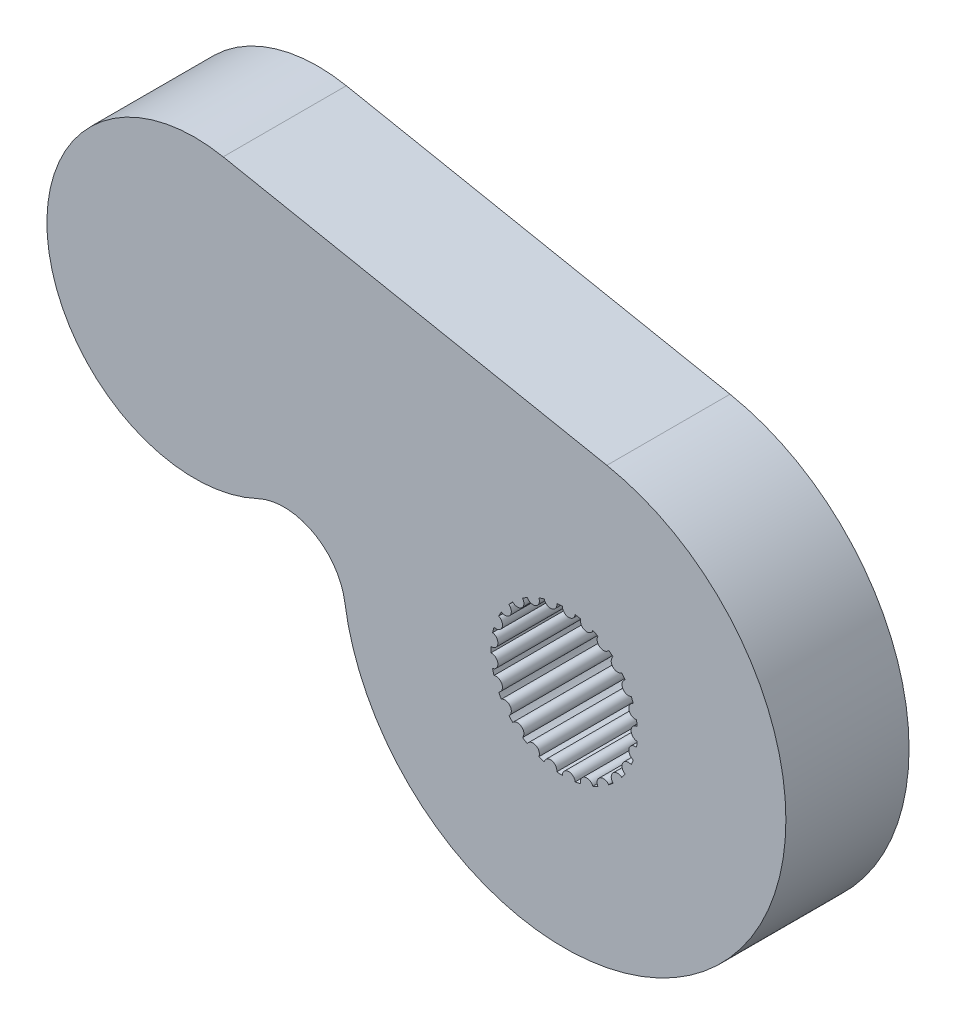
SolidWorks part; units mm, degrees
ref_plane "Plan de face" through (0, 0, 0) normal (0, 0, 1) x (1, 0, 0)
ref_plane "Plan de dessus" through (0, 0, 0) normal (0, 1, 0) x (1, 0, 0)
ref_plane "Plan de droite" through (0, 0, 0) normal (1, 0, 0) x (0, 0, -1)
sketch "Esquisse1" plane through (0, 0, 0) normal (0, 0, 1) x (1, 0, 0)
  line L0 (0, 0) -> (-29.8495, 0) construction
  line L1 (-15, 14.3723) -> (-15, -5.8431) construction
  line L2 (-13.8449, 11.8878) -> (1.7327, 8.8316)
  circle A0 centre (0, 0) radius 2.975
  arc A1 (-8.9025, -1.3214) -> (1.7327, 8.8316) centre (0, 0) ccw
  arc A2 (-13.8449, 11.8878) -> (-12.4414, 0.5729) centre (-15, 6) ccw
  arc A3 (-8.9025, -1.3214) -> (-12.4414, 0.5729) centre (-11.3754, -1.6884) ccw
  dimension "D1" = 5.95
  dimension "D2" = 18
  dimension "D3" = 15
  dimension "D4" = 12
  dimension "D5" = 5
extrude "Boss.-Extru.1" add sketch "Esquisse1" along normal blind 5
sketch "Esquisse4" plane through (0, 0, 5) normal (0, 0, 1) x (1, 0, 0)
  circle A0 centre (2.975, 0) radius 0.26
  circle A1 centre (0, 0) radius 2.975 construction
  circle A2 centre (2.8815, -0.7399) radius 0.26
  circle A3 centre (2.607, -1.4332) radius 0.26
  circle A4 centre (2.1687, -2.0365) radius 0.26
  circle A5 centre (1.5941, -2.5119) radius 0.26
  circle A6 centre (0.9193, -2.8294) radius 0.26
  circle A7 centre (0.1868, -2.9691) radius 0.26
  circle A8 centre (-0.5575, -2.9223) radius 0.26
  circle A9 centre (-1.2667, -2.6919) radius 0.26
  circle A10 centre (-1.8963, -2.2923) radius 0.26
  circle A11 centre (-2.4068, -1.7487) radius 0.26
  circle A12 centre (-2.7661, -1.0952) radius 0.26
  circle A13 centre (-2.9515, -0.3729) radius 0.26
  circle A14 centre (-2.9515, 0.3729) radius 0.26
  circle A15 centre (-2.7661, 1.0952) radius 0.26
  circle A16 centre (-2.4068, 1.7487) radius 0.26
  circle A17 centre (-1.8963, 2.2923) radius 0.26
  circle A18 centre (-1.2667, 2.6919) radius 0.26
  circle A19 centre (-0.5575, 2.9223) radius 0.26
  circle A20 centre (0.1868, 2.9691) radius 0.26
  circle A21 centre (0.9193, 2.8294) radius 0.26
  circle A22 centre (1.5941, 2.5119) radius 0.26
  circle A23 centre (2.1687, 2.0365) radius 0.26
  circle A24 centre (2.607, 1.4332) radius 0.26
  circle A25 centre (2.8815, 0.7399) radius 0.26
  point P55 (0, 0)
  dimension "D1" = 0.52
  dimension "D2" = 25
extrude "Boss.-Extru.3" add sketch "Esquisse4" against normal blind 5
